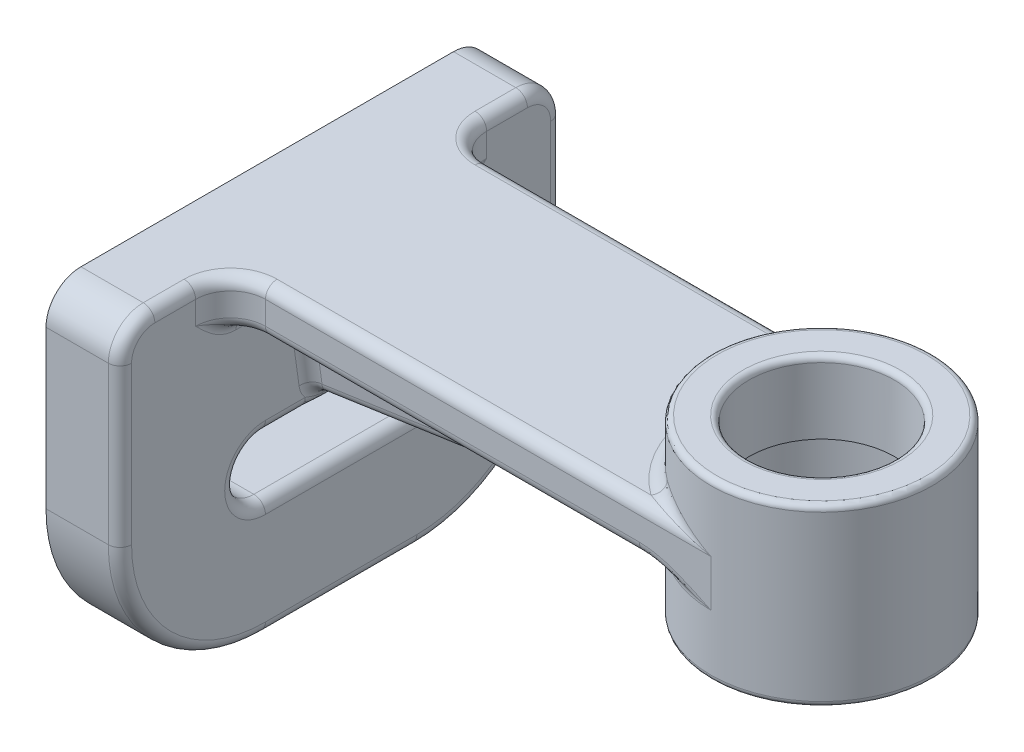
SolidWorks part; units mm, degrees
ref_plane "Front" through (0, 0, 0) normal (0, 0, 1) x (1, 0, 0)
ref_plane "Top" through (0, 0, 0) normal (0, 1, 0) x (1, 0, 0)
ref_plane "Right" through (0, 0, 0) normal (1, 0, 0) x (0, 0, -1)
sketch "Sketch1" plane through (0, 0, 0) normal (1, 0, 0) x (0, 0, -1)
  line L0 (0, 0) -> (76, 0)
  line L1 (0, 0) -> (0, 58)
  line L2 (76, 58) -> (0, 58)
  line L3 (76, 58) -> (76, 0)
  dimension "D1" = 76
  dimension "D2" = 58
extrude "Base-Extrude" add sketch "Sketch1" along normal blind 12.7
sketch "Sketch2" plane through (12.7, 0, 0) normal (1, 0, 0) x (0, 0, -1)
  line L0 (19, 58) -> (57, 58)
  line L1 (19, 58) -> (19, 50)
  line L2 (57, 50) -> (19, 50)
  line L3 (57, 50) -> (57, 58)
  line L4 (76, 58) -> (0, 58) construction
  line L5 (38, 58) -> (38, 0) construction
  line L6 (0, 0) -> (76, 0) construction
  dimension "D1" = 8
  dimension "D2" = 38
extrude "Boss-Extrude3" add sketch "Sketch2" along normal offset from surface (82.55 mm away) 95.25
ref_plane "Plane4" through (0, 67.525, 0) normal (0, 1, 0) x (-1, 0, 0)
sketch "Sketch4" plane through (0, 67.525, 0) normal (0, 1, 0) x (-1, 0, 0)
  line L0 (-95.25, -57) -> (-95.25, -19) construction
  circle A0 centre (-95.25, -38) radius 19
extrude "Boss-Extrude4" add sketch "Sketch4" against normal blind 30.1625
sketch "Sketch7" plane through (0, 0, 0) normal (0, 1, 0) x (1, 0, 0)
  line L0 (12.7, 0) -> (12.7, 76) construction
  point P0 (12.7, 38)
fillet "Fillet1" radius 6 6 edges at (6.35, 58, -76) (6.35, 58, 0)
fillet "Fillet2" radius 25 2 edges at (6.35, 0, 0) (6.35, 0, -76)
fillet "Fillet5" radius 2 13 edges at (12.7, 38.5, -76) (12.7, 56.2426, -1.7574) (12.7, 56.2426, -74.2426) (14.4574, 58, -17.2426) (14.4574, 58, -58.7574) (12.7, 0, -38) (12.7, 38.5, 0) (12.7, 7.3223, -68.6777) (12.7, 7.3223, -7.3223)
fillet "Fillet6" radius 2 3 edges at (76.25, 58, -38) (90.1511, 57.5173, -19.697) (90.1511, 57.5173, -56.303)
fillet "Fillet10" radius 2 1 edges at (76.25, 50, -38)
other "Hole5"
sketch "Sketch14" plane through (0, 67.525, 0) normal (0, 1, 0) x (-1, 0, 0)
  circle A0 centre (-95.25, -38) radius 12.5
  circle A3 centre (-95.25, -38) radius 19 construction
  dimension "D1" = 25
sketch "Croquis1" plane through (0, 37.3625, 0) normal (0, -1, 0) x (1, 0, 0)
  circle A0 centre (95.25, -38) radius 15
  dimension "D1" = 30
extrude "Cortar-Extruir1" cut sketch "Croquis1" against normal blind 17.78
sketch "Croquis2" plane through (12.7, 0, 0) normal (1, 0, 0) x (0, 0, -1)
  line L0 (25, 30) -> (51, 30)
  line L1 (51, 20) -> (25, 20)
  arc A0 (25, 30) -> (25, 20) centre (25, 25) ccw
  arc A1 (51, 20) -> (51, 30) centre (51, 25) ccw
  dimension "D1" = 10
  dimension "D2" = 10
extrude "Cortar-Extruir2" cut sketch "Croquis2" against normal through all
ref_plane "Plano1" through (0, 0, -38) normal (0, 0, -1) x (-1, 0, 0)
sketch "Croquis3" plane through (0, 0, -38) normal (0, 0, -1) x (-1, 0, 0)
  line L0 (-79.4681, 42.2415) -> (-8.1955, 31.7964)
rib "Nervio1" sketch "Croquis3" sketch "Croquis3" thickness 10 extrusion direction parallel to sketch draft on yes draft angle 8 parameters "D1"=10, "D3"=8
fillet "Redondeo1" radius 2 12 edges at (76.25, 41.7699, -38) (44.8098, 37.1623, -33) (12.7, 32.4565, -38) (43.9379, 50, -44.8029) (77.041, 44.9438, -43.4252) (44.8098, 37.1623, -43) (12.7, 41.2282, -44.2198) (76.7283, 49.3009, -44.0375) (12.7, 41.2282, -31.7802) (76.7283, 49.3009, -31.9625) (43.9379, 50, -31.1971) (77.041, 44.9438, -32.5748)
fillet "Redondeo2" radius 2 6 edges at (52.5029, 50, -57) (90.3057, 49.4597, -57) (12.7, 50, -55.2092) (12.7035, 50, -47.2994) (13.3566, 49.5084, -45.8542) (14.4574, 50, -58.7574)
fillet "Redondeo3" radius 2 5 edges at (90.3057, 49.4597, -19) (13.3566, 49.5084, -30.1458) (14.4574, 50, -17.2426) (52.5029, 50, -19) (12.7, 50, -20.7908)
fillet "Redondeo4" radius 2 4 edges at (12.7, 25, -20) (12.7, 30, -38) (12.7, 25, -56) (12.7, 20, -38)
chamfer "Chaflán1" distance 2 angle 45 1 edges at (95.25, 37.3625, -53)
fillet "Redondeo5" radius 1 1 edges at (95.25, 37.3625, -19)
fillet "Redondeo6" radius 1 1 edges at (95.25, 67.525, -19)
fillet "Redondeo7" radius 1 1 edges at (95.25, 67.525, -25.5)
ref_plane "Plano2" through (0, 0, 0) normal (-1, 0, 0) x (0, 0, 1)
